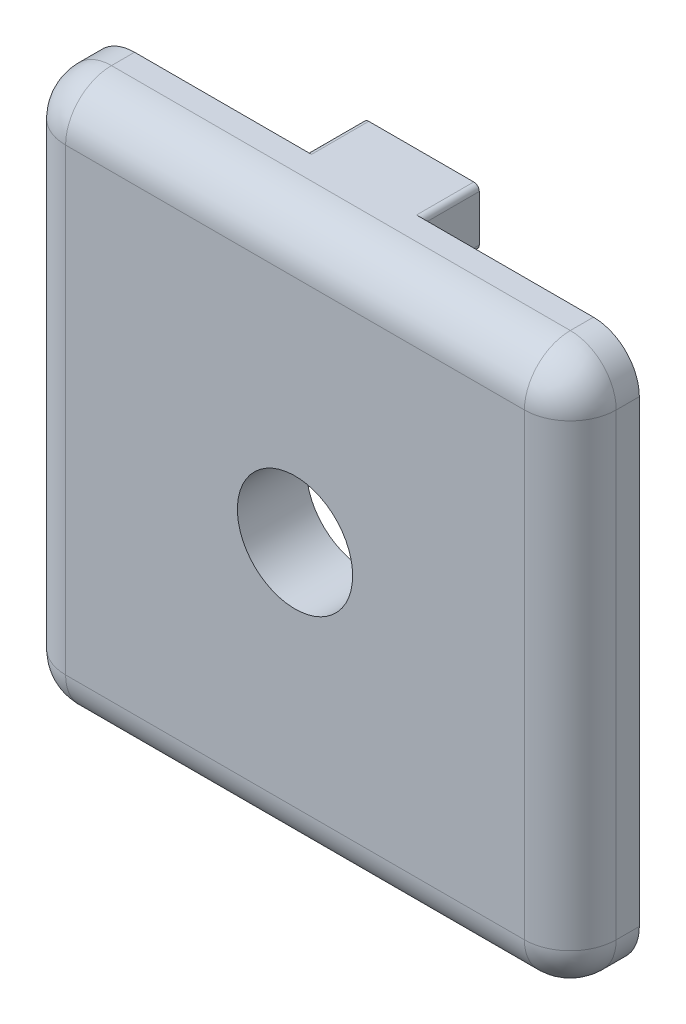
SolidWorks part; units mm, degrees
ref_plane "Front Plane" through (0, 0, 0) normal (0, 0, 1) x (1, 0, 0)
ref_plane "Top Plane" through (0, 0, 0) normal (0, 1, 0) x (1, 0, 0)
ref_plane "Right Plane" through (0, 0, 0) normal (1, 0, 0) x (0, 0, -1)
sketch "Sketch1" plane through (0, 0, 0) normal (0, 0, 1) x (1, 0, 0)
  line L0 (-19.05, 0) -> (19.05, 0) construction
  line L1 (-19.05, 19.05) -> (19.05, 19.05)
  line L2 (-19.05, 19.05) -> (-19.05, -19.05)
  line L3 (-19.05, -19.05) -> (19.05, -19.05)
  line L4 (19.05, 19.05) -> (19.05, -19.05)
  line L5 (0, 19.05) -> (0, -19.05) construction
  dimension "D1" = 38.1
  dimension "D2" = 38.1
extrude "Boss-Extrude1" add sketch "Sketch1" along normal blind 4.7752
fillet "Fillet1" radius 3.175 8 edges at (0, 19.05, 4.7752) (19.05, 0, 4.7752) (0, -19.05, 4.7752) (-19.05, 0, 4.7752) (-19.05, -19.05, 2.3876) (19.05, -19.05, 2.3876) (19.05, 19.05, 2.3876) (-19.05, 19.05, 2.3876)
sketch "Sketch2" plane through (0, 0, 4.7752) normal (0, 0, 1) x (1, 0, 0)
  circle A0 centre (0, 0) radius 3.9878
  dimension "D2" = 7.9756
extrude "Cut-Extrude1" cut sketch "Sketch2" against normal up to next
sketch "Sketch3" plane through (0, 0, 0) normal (0, 0, -1) x (-1, 0, 0)
  line L0 (-15.875, 19.05) -> (15.875, 19.05) construction
  line L1 (-4.0132, 19.05) -> (4.0132, 19.05)
  line L2 (-4.0132, 19.05) -> (-4.0132, 15.0876)
  line L3 (-4.0132, 15.0876) -> (4.0132, 15.0876)
  line L4 (4.0132, 19.05) -> (4.0132, 15.0876)
  line L5 (0, 0) -> (0, 19.05) construction
  dimension "D1" = 8.0264
  dimension "D2" = 3.9624
extrude "Boss-Extrude2" add sketch "Sketch3" along normal blind 3.9624
fillet "Fillet2" radius 0.381 4 edges at (-4.0132, 15.0876, -1.9812) (4.0132, 15.0876, -1.9812)
